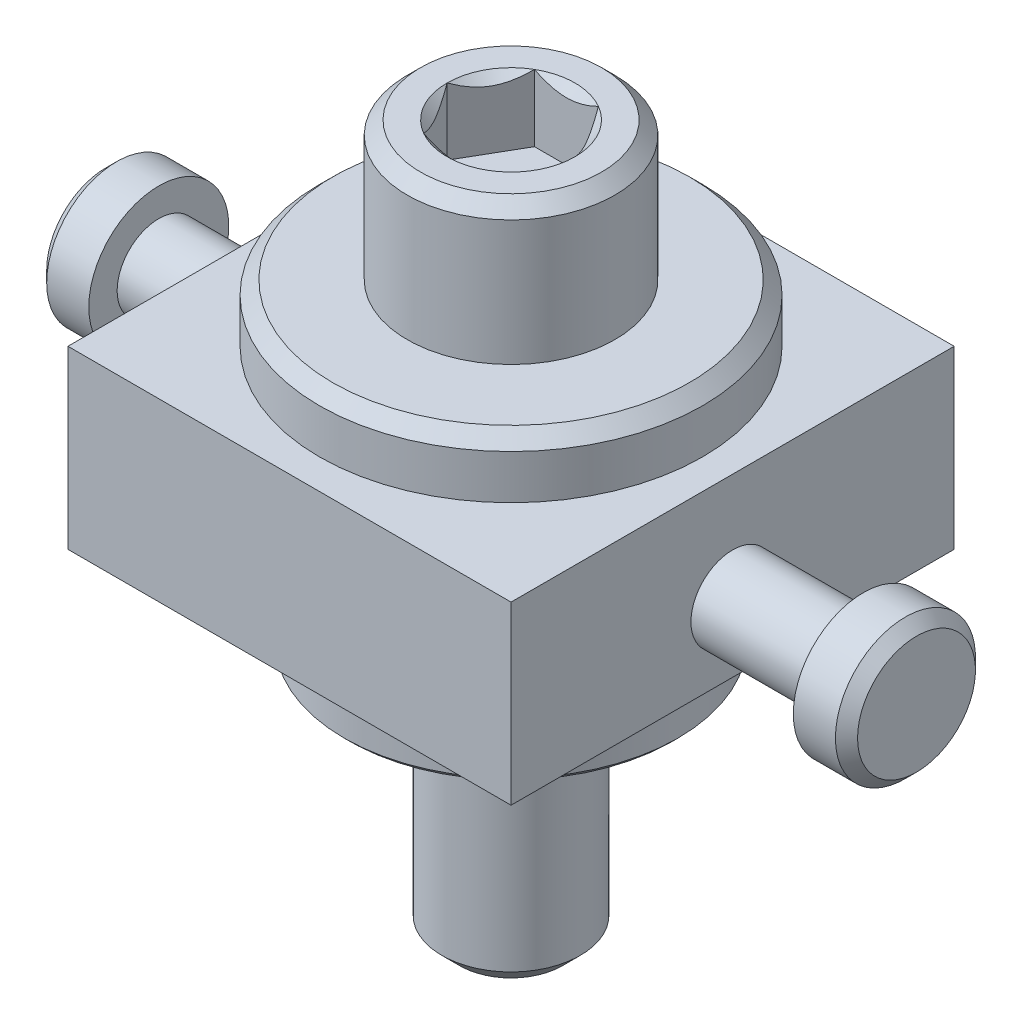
SolidWorks part; units mm, degrees
ref_plane "Front" through (0, 0, 0) normal (0, 0, 1) x (1, 0, 0)
ref_plane "Top" through (0, 0, 0) normal (0, 1, 0) x (1, 0, 0)
ref_plane "Right" through (0, 0, 0) normal (1, 0, 0) x (0, 0, -1)
sketch "Sketch1" plane through (0, 0, 0) normal (0, 0, 1) x (1, 0, 0)
  line L0 (3.9688, 0) -> (9.252, 0)
  line L1 (9.252, 0) -> (9.5567, 0.3048)
  line L2 (9.5567, 0.3048) -> (9.5567, 4.9022)
  line L3 (9.5567, 4.9022) -> (18.7452, 4.9022)
  line L4 (18.7452, 4.9022) -> (19.05, 5.207)
  line L5 (19.05, 5.207) -> (19.05, 14.6812)
  line L6 (19.05, 14.6812) -> (18.7452, 14.986)
  line L7 (18.7452, 14.986) -> (10.9855, 14.986)
  line L8 (10.9855, 14.986) -> (10.9855, 17.526)
  line L9 (10.9855, 17.526) -> (10.2235, 18.288)
  line L10 (10.2235, 18.288) -> (5.9531, 18.288)
  line L11 (5.9531, 18.288) -> (5.9531, 25.4635)
  line L12 (5.9531, 25.4635) -> (5.1911, 26.2255)
  line L13 (5.1911, 26.2255) -> (0, 26.2255)
  line L14 (3.9688, 0) -> (3.9688, -13.2715)
  line L15 (3.9688, -13.2715) -> (2.9527, -14.2875)
  line L16 (2.9527, -14.2875) -> (0, -14.2875)
  line L17 (0, -14.2875) -> (0, 84.0078) construction
  line L18 (0, -14.2875) -> (0, 26.2255)
  dimension "D1" = 7.9375
  dimension "D2" = 45
  dimension "D3" = 1.016
  dimension "D4" = 11.9062
  dimension "D5" = 45
  dimension "D6" = 0.762
  dimension "D7" = 7.9375
  dimension "D8" = 45
  dimension "D9" = 0.762
  dimension "D10" = 21.971
  dimension "D11" = 3.302
  dimension "D12" = 45
  dimension "D13" = 0.3048
  dimension "D14" = 10.0838
  dimension "D15" = 14.986
  dimension "D16" = 38.1
  dimension "D17" = 45
  dimension "D18" = 0.3048
  dimension "D19" = 45
  dimension "D20" = 0.3048
  dimension "D21" = 19.1135
  dimension "D22" = 14.2875
revolve "Base-Revolve" add sketch "Sketch1" angle 360 about L17
sketch "Sketch2" plane through (0, 14.986, 0) normal (0, 1, 0) x (-1, 0, 0)
  line L0 (12.7, -12.7) -> (-12.7, 12.7) construction
  line L1 (-12.7, -12.7) -> (12.7, -12.7)
  line L2 (-12.7, -12.7) -> (-12.7, 12.7)
  line L3 (-12.7, 12.7) -> (12.7, 12.7)
  line L4 (12.7, -12.7) -> (12.7, 12.7)
  dimension "D1" = 25.4
  dimension "D2" = 25.4
extrude "Cut-Extrude1" cut sketch "Sketch2" against normal through all flip side to cut
sketch "Sketch3" plane through (0, 26.2255, 0) normal (0, 1, 0) x (-1, 0, 0)
  line L1 (3.6662, 0) -> (1.8331, 3.175)
  line L2 (1.8331, 3.175) -> (-1.8331, 3.175)
  line L3 (-1.8331, 3.175) -> (-3.6662, 0)
  line L4 (-3.6662, 0) -> (-1.8331, -3.175)
  line L5 (-1.8331, -3.175) -> (1.8331, -3.175)
  line L6 (1.8331, -3.175) -> (3.6662, 0)
  circle A0 centre (0, 0) radius 3.175 construction
  dimension "D1" = 6.35
extrude "Cut-Extrude2" cut sketch "Sketch3" against normal blind 3.8354
sketch "Sketch4" plane through (0, 26.2255, 0) normal (0, 1, 0) x (-1, 0, 0)
  circle A0 centre (0, 0) radius 3.6662
extrude "Cut-Extrude3" cut sketch "Sketch4" against normal up to next draft 45
sketch "Sketch6" plane through (0, 0, 0) normal (0, 0, 1) x (1, 0, 0)
  line L0 (-23.241, 8.8392) -> (23.241, 8.8392) construction
  line L1 (23.241, 8.8392) -> (-23.241, 8.8392)
  line L3 (-20.193, 11.2268) -> (20.193, 11.2268)
  line L4 (20.193, 11.2268) -> (20.193, 12.8524)
  line L5 (20.193, 12.8524) -> (22.606, 12.8524)
  line L6 (22.606, 12.8524) -> (23.241, 12.2174)
  line L7 (23.241, 12.2174) -> (23.241, 8.8392)
  line L10 (-22.606, 12.8524) -> (-23.241, 12.2174)
  line L11 (-20.193, 12.8524) -> (-22.606, 12.8524)
  line L12 (-20.193, 11.2268) -> (-20.193, 12.8524)
  line L14 (-23.241, 12.2174) -> (-23.241, 8.8392)
  dimension "D1" = 3.937
  dimension "D2" = 4.7752
  dimension "D3" = 8.0264
  dimension "D4" = 45
  dimension "D5" = 0.635
  dimension "D6" = 3.048
  dimension "D7" = 40.386
  dimension "D8" = 20.193
  dimension "D9" = 3.048
  dimension "D10" = 8.0264
  dimension "D11" = 45
  dimension "D12" = 0.635
revolve "Boss-Revolve1" add sketch "Sketch6" angle 360 about L0
